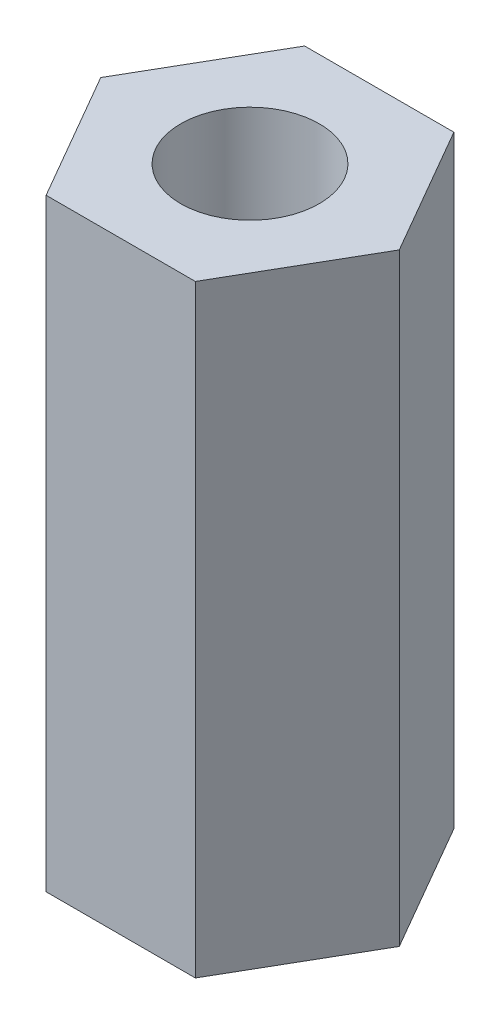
SolidWorks part; units mm, degrees
ref_plane "Front" through (0, 0, 0) normal (0, 0, 1) x (1, 0, 0)
ref_plane "Top" through (0, 0, 0) normal (0, 1, 0) x (1, 0, 0)
ref_plane "Right" through (0, 0, 0) normal (1, 0, 0) x (0, 0, -1)
sketch "Sketch1" plane through (0, 0, 0) normal (0, 1, 0) x (1, 0, 0)
  line L0 (-5.4993, 0) -> (-2.7496, 4.7625)
  line L1 (-2.7496, 4.7625) -> (2.7496, 4.7625)
  line L2 (2.7496, 4.7625) -> (5.4993, 0)
  line L3 (5.4993, 0) -> (2.7496, -4.7625)
  line L4 (2.7496, -4.7625) -> (-2.7496, -4.7625)
  line L5 (-2.7496, -4.7625) -> (-5.4993, 0)
  line L6 (-2.7496, 4.7625) -> (2.7496, -4.7625) construction
  line L7 (-2.7496, -4.7625) -> (2.7496, 4.7625) construction
  line L8 (-5.4993, 0) -> (5.4993, 0) construction
  point P2 (0, 0)
  dimension "D1" = 9.525
extrude "Boss-Extrude1" add sketch "Sketch1" along normal mid plane 22.225
hole_wizard "1/4-20 Tapped Hole1" positions "Sketch3" profile "Sketch2" tap size "1/4-20" standard "Ansi Inch"
sketch "Sketch3" plane through (0, 11.1125, 0) normal (0, 1, 0) x (-1, 0, 0)
  point P0 (0, 0)
sketch "Sketch2" plane through (0, 11.1125, 0) normal (1, 0, 0) x (0, 0, 1)
  line L0 (0, 0) -> (0, 22.225)
  line L1 (0, 22.225) -> (2.5527, 22.225)
  line L2 (2.5527, 22.225) -> (2.5527, 0)
  line L5 (2.5527, 0) -> (0, 0)
  line L11 (0, -6.35) -> (0, 107.95) construction
  dimension "Thru Tap Drill Dia." = 5.1054
  dimension "Thru Tap Drill Depth" = 22.225
